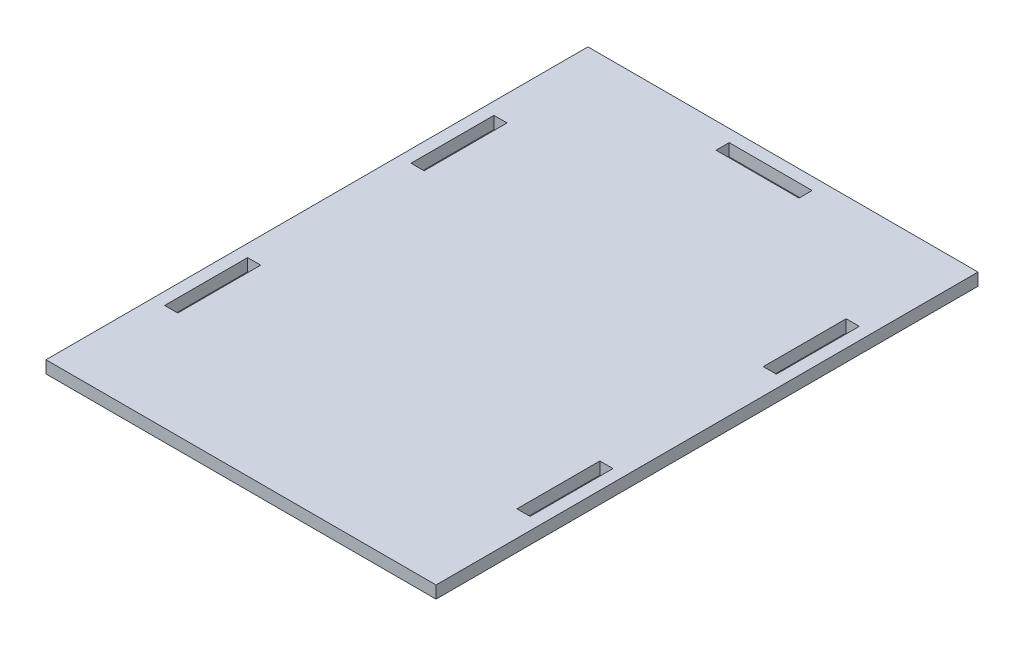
SolidWorks part; units mm, degrees
ref_plane "Alzado" through (0, 0, 0) normal (0, 0, 1) x (1, 0, 0)
ref_plane "Planta" through (0, 0, 0) normal (0, 1, 0) x (1, 0, 0)
ref_plane "Vista lateral" through (0, 0, 0) normal (1, 0, 0) x (0, 0, -1)
sketch "Croquis1" plane through (0, 0, 0) normal (0, 1, 0) x (1, 0, 0)
  line L1 (222.5, -315) -> (-222.5, -315)
  line L2 (222.5, -315) -> (222.5, 315)
  line L3 (222.5, 315) -> (-222.5, 315)
  line L4 (-222.5, -315) -> (-222.5, 315)
  line L5 (222.5, -315) -> (-222.5, 315) construction
  line L6 (222.5, 315) -> (-222.5, -315) construction
  point P0 (0, 0)
extrude "Saliente-Extruir1" add sketch "Croquis1" along normal blind 15
sketch "Croquis2" plane through (0, 15, 0) normal (0, 1, 0) x (1, 0, 0)
  line L0 (222.5, -315) -> (222.5, 315) construction
  line L1 (-237.5, 330) -> (237.5, 330)
  line L2 (-237.5, 330) -> (-237.5, -330)
  line L3 (-237.5, -330) -> (237.5, -330)
  line L4 (237.5, 330) -> (237.5, -330)
  line L5 (-237.5, 330) -> (237.5, -330) construction
  line L6 (-237.5, -330) -> (237.5, 330) construction
  line L7 (222.5, 315) -> (-222.5, 315) construction
  line L9 (222.5, -315) -> (-222.5, -315)
  line L10 (222.5, -315) -> (222.5, 315)
  line L11 (222.5, 315) -> (-222.5, 315)
  line L12 (-222.5, -315) -> (-222.5, 315)
  line L13 (222.5, -315) -> (-222.5, 315) construction
  line L14 (222.5, 315) -> (-222.5, -315) construction
  point P0 (0, 0)
  point P10 (0, 0)
extrude "Saliente-Extruir2" add sketch "Croquis2" against normal blind 15
sketch "Croquis3" plane through (0, 15, 0) normal (0, 1, 0) x (1, 0, 0)
  line L0 (-222.5, -315) -> (-222.5, 315) construction
  line L1 (-222.5, 200.5) -> (-206.5, 200.5)
  line L2 (-222.5, 200.5) -> (-222.5, 99.5)
  line L3 (-222.5, 99.5) -> (-206.5, 99.5)
  line L4 (-206.5, 200.5) -> (-206.5, 99.5)
  line L5 (222.5, 315) -> (-222.5, 315) construction
  line L6 (-222.5, -99.5) -> (-206.5, -99.5)
  line L7 (-222.5, -99.5) -> (-222.5, -200.5)
  line L8 (-222.5, -200.5) -> (-206.5, -200.5)
  line L9 (-206.5, -99.5) -> (-206.5, -200.5)
  line L10 (-50.5, 315) -> (50.5, 315)
  line L11 (-50.5, 315) -> (-50.5, 299)
  line L12 (-50.5, 299) -> (50.5, 299)
  line L13 (50.5, 315) -> (50.5, 299)
  line L14 (206.5, -99.5) -> (206.5, -200.5)
  line L15 (-222.5, -315) -> (-222.5, -150) construction
  line L16 (-222.5, -150) -> (-222.5, 150) construction
  line L17 (-222.5, 150) -> (-222.5, 315) construction
  line L18 (222.5, -200.5) -> (206.5, -200.5)
  line L19 (222.5, -99.5) -> (222.5, -200.5)
  line L20 (0, 0) -> (0, -315) construction
  line L21 (222.5, -315) -> (-222.5, -315) construction
  line L22 (222.5, -99.5) -> (206.5, -99.5)
  line L23 (206.5, 200.5) -> (206.5, 99.5)
  line L24 (222.5, 99.5) -> (206.5, 99.5)
  line L25 (222.5, 200.5) -> (222.5, 99.5)
  line L26 (222.5, 200.5) -> (206.5, 200.5)
  point P16 (0, 315)
  point P27 (-222.5, -150)
  point P28 (-222.5, 150)
extrude "Cortar-Extruir1" cut sketch "Croquis3" against normal through all
equation "\"profmueble\"= \"profbase\" + 200 + 2 * \"thicknes\""
equation "\"D2@Croquis1\"=\"anchbase\" + 3 * \"thicknes\""
equation "\"thicknes\"=15"
equation "\"profbase\"= 400"
equation "\"anchbase\"= 400"
equation "\"altura\"=150"
equation "\"clearens\"=1"
equation "\"joind1\"=100"
equation "\"D1@Saliente-Extruir1\"=\"thicknes\""
equation "\"D1@Croquis1\"=\"profmueble\""
equation "\"D1@Croquis2\"=\"thicknes\""
equation "\"D2@Croquis2\"=\"thicknes\""
equation "\"D1@Saliente-Extruir2\"=\"thicknes\""
equation "\"D1@Croquis3\"=\"joind1\"+\"clearens\""
equation "\"D2@Croquis3\"=\"thicknes\"+\"clearens\""
equation "\"D3@Croquis3\"=\"joind1\"+\"clearens\""
equation "\"D4@Croquis3\"=\"thicknes\"+\"clearens\""
